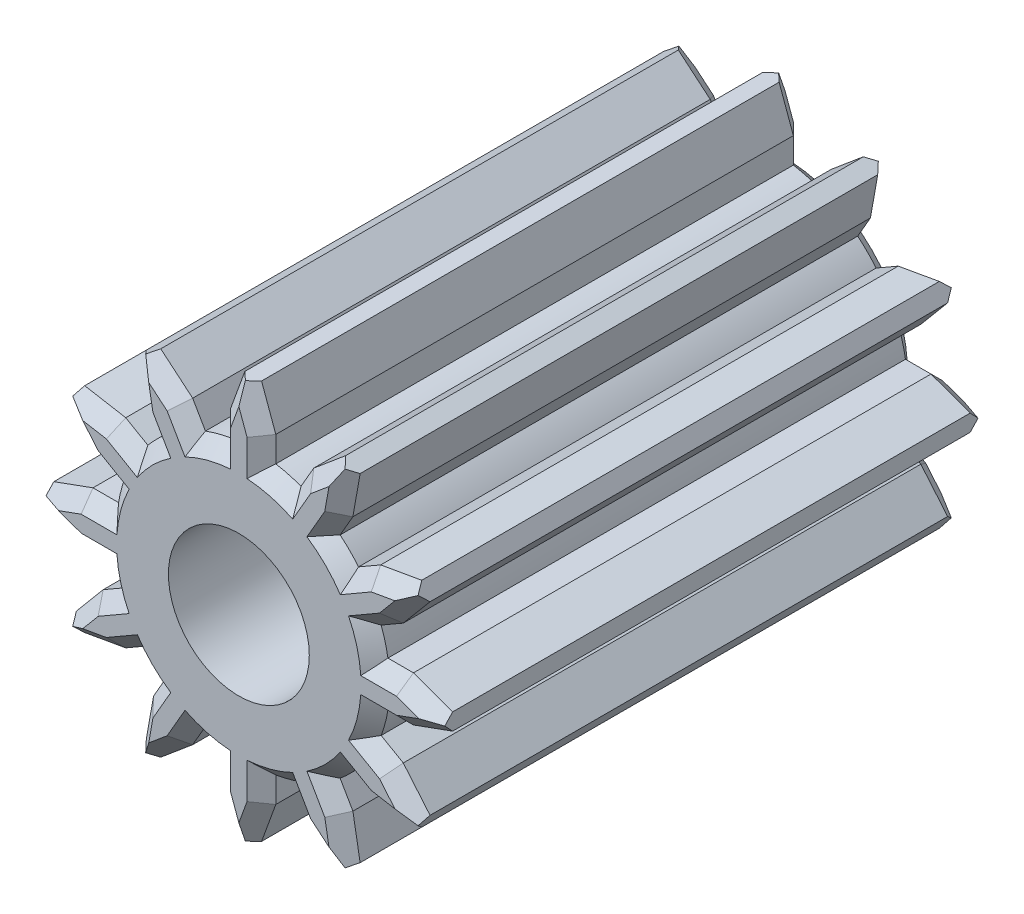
SolidWorks part; units mm, degrees
ref_plane "Piano frontale" through (0, 0, 0) normal (0, 0, 1) x (1, 0, 0)
ref_plane "Piano superiore" through (0, 0, 0) normal (0, 1, 0) x (1, 0, 0)
ref_plane "Piano destro" through (0, 0, 0) normal (1, 0, 0) x (0, 0, -1)
sketch "Schizzo1" plane through (0, 0, 0) normal (0, 0, 1) x (1, 0, 0)
  line L0 (-0.7855, 4.6846) -> (-0.7855, 5.5726)
  line L1 (-0.7855, 5.5726) -> (-0.2898, 6.9346)
  line L2 (-0.2898, 6.9346) -> (0.2898, 6.9346)
  line L3 (0.2898, 6.9346) -> (0.7855, 5.5726)
  line L4 (0.7855, 5.5726) -> (0.7855, 4.6846)
  line L5 (0, -8.4939) -> (0, 8.1917) construction
  line L6 (2.106, 5.2188) -> (3.2164, 6.1504)
  line L7 (1.662, 4.4497) -> (2.106, 5.2188)
  line L8 (3.7183, 5.8607) -> (3.4666, 4.4333)
  line L9 (3.4666, 4.4333) -> (3.0226, 3.6642)
  line L10 (3.2164, 6.1504) -> (3.7183, 5.8607)
  line L11 (4.4333, 3.4666) -> (5.8607, 3.7183)
  line L12 (3.6642, 3.0226) -> (4.4333, 3.4666)
  line L13 (6.1504, 3.2164) -> (5.2188, 2.106)
  line L14 (5.2188, 2.106) -> (4.4497, 1.662)
  line L15 (5.8607, 3.7183) -> (6.1504, 3.2164)
  line L16 (5.5726, 0.7855) -> (6.9346, 0.2898)
  line L17 (4.6846, 0.7855) -> (5.5726, 0.7855)
  line L18 (6.9346, -0.2898) -> (5.5726, -0.7855)
  line L19 (5.5726, -0.7855) -> (4.6846, -0.7855)
  line L20 (6.9346, 0.2898) -> (6.9346, -0.2898)
  line L21 (5.2188, -2.106) -> (6.1504, -3.2164)
  line L22 (4.4497, -1.662) -> (5.2188, -2.106)
  line L23 (5.8607, -3.7183) -> (4.4333, -3.4666)
  line L24 (4.4333, -3.4666) -> (3.6642, -3.0226)
  line L25 (6.1504, -3.2164) -> (5.8607, -3.7183)
  line L26 (3.4666, -4.4333) -> (3.7183, -5.8607)
  line L27 (3.0226, -3.6642) -> (3.4666, -4.4333)
  line L28 (3.2164, -6.1504) -> (2.106, -5.2188)
  line L29 (2.106, -5.2188) -> (1.662, -4.4497)
  line L30 (3.7183, -5.8607) -> (3.2164, -6.1504)
  line L31 (0.7855, -5.5726) -> (0.2898, -6.9346)
  line L32 (0.7855, -4.6846) -> (0.7855, -5.5726)
  line L33 (-0.2898, -6.9346) -> (-0.7855, -5.5726)
  line L34 (-0.7855, -5.5726) -> (-0.7855, -4.6846)
  line L35 (0.2898, -6.9346) -> (-0.2898, -6.9346)
  line L36 (-2.106, -5.2188) -> (-3.2164, -6.1504)
  line L37 (-1.662, -4.4497) -> (-2.106, -5.2188)
  line L38 (-3.7183, -5.8607) -> (-3.4666, -4.4333)
  line L39 (-3.4666, -4.4333) -> (-3.0226, -3.6642)
  line L40 (-3.2164, -6.1504) -> (-3.7183, -5.8607)
  line L41 (-4.4333, -3.4666) -> (-5.8607, -3.7183)
  line L42 (-3.6642, -3.0226) -> (-4.4333, -3.4666)
  line L43 (-6.1504, -3.2164) -> (-5.2188, -2.106)
  line L44 (-5.2188, -2.106) -> (-4.4497, -1.662)
  line L45 (-5.8607, -3.7183) -> (-6.1504, -3.2164)
  line L46 (-5.5726, -0.7855) -> (-6.9346, -0.2898)
  line L47 (-4.6846, -0.7855) -> (-5.5726, -0.7855)
  line L48 (-6.9346, 0.2898) -> (-5.5726, 0.7855)
  line L49 (-5.5726, 0.7855) -> (-4.6846, 0.7855)
  line L50 (-6.9346, -0.2898) -> (-6.9346, 0.2898)
  line L51 (-5.2188, 2.106) -> (-6.1504, 3.2164)
  line L52 (-4.4497, 1.662) -> (-5.2188, 2.106)
  line L53 (-5.8607, 3.7183) -> (-4.4333, 3.4666)
  line L54 (-4.4333, 3.4666) -> (-3.6642, 3.0226)
  line L55 (-6.1504, 3.2164) -> (-5.8607, 3.7183)
  line L56 (-3.4666, 4.4333) -> (-3.7183, 5.8607)
  line L57 (-3.0226, 3.6642) -> (-3.4666, 4.4333)
  line L58 (-3.2164, 6.1504) -> (-2.106, 5.2188)
  line L59 (-2.106, 5.2188) -> (-1.662, 4.4497)
  line L60 (-3.7183, 5.8607) -> (-3.2164, 6.1504)
  circle A0 centre (0, 0) radius 4.75
  point P79 (0, 0)
  dimension "D2" = 9.5
  dimension "D1" = 20
  dimension "D3" = 2.25
  dimension "D4" = 1.571
  dimension "D5" = 1.362
  dimension "D6" = 12
extrude "Estrusione-Estrusione1" add sketch "Schizzo1" along normal blind 19 contours A0 L5 | L5 A0 | L5 A0 L4 L3 L2 | A0 L5 L2 L1 L0 | A0 L59 L58 L60 L56 L57 | A0 L54 L53 L55 L51 L52 | A0 L49 L48 L50 L46 L47 | A0 L44 L43 L45 L41 L42 | A0 L39 L38 L40 L36 L37 | L5 L35 L31 L32 A0 | L35 L5 A0 L34 L33 | A0 L29 L28 L30 L26 L27 | A0 L24 L23 L25 L21 L22 | A0 L19 L18 L20 L16 L17 | A0 L14 L13 L15 L11 L12 | A0 L9 L8 L10 L6 L7
chamfer "Smusso1" distance 0.5 angle 45 144 edges at (0.7855, 5.1286, 0) (0.7855, 5.1286, 19) (1.2294, 4.5881, 19) (1.2294, 4.5881, 0) (1.884, 4.8342, 0) (1.884, 4.8342, 19) (2.6612, 5.6846, 0) (2.6612, 5.6846, 19) (3.5924, 5.147, 0) (3.5924, 5.147, 19) (3.2446, 4.0487, 0) (3.2446, 4.0487, 19) (3.3588, 3.3588, 19) (3.3588, 3.3588, 0) (4.0487, 3.2446, 0) (4.0487, 3.2446, 19) (5.147, 3.5924, 0) (5.147, 3.5924, 19) (5.6846, 2.6612, 0) (5.6846, 2.6612, 19) (4.8342, 1.884, 0) (4.8342, 1.884, 19) (4.5881, 1.2294, 19) (4.5881, 1.2294, 0) (5.1286, 0.7855, 0) (5.1286, 0.7855, 19) (6.2536, 0.5376, 0) (6.2536, 0.5376, 19) (6.2536, -0.5376, 0) (6.2536, -0.5376, 19) (5.1286, -0.7855, 0) (5.1286, -0.7855, 19) (4.5881, -1.2294, 19) (4.5881, -1.2294, 0) (4.8342, -1.884, 0) (4.8342, -1.884, 19) (5.6846, -2.6612, 0) (5.6846, -2.6612, 19) (5.147, -3.5924, 0) (5.147, -3.5924, 19) (4.0487, -3.2446, 0) (4.0487, -3.2446, 19) (3.3588, -3.3588, 19) (3.3588, -3.3588, 0) (3.2446, -4.0487, 0) (3.2446, -4.0487, 19) (3.5924, -5.147, 0) (3.5924, -5.147, 19) (2.6612, -5.6846, 0) (2.6612, -5.6846, 19) (1.884, -4.8342, 0) (1.884, -4.8342, 19) (1.2294, -4.5881, 19) (1.2294, -4.5881, 0) (0.7855, -5.1286, 0) (0.7855, -5.1286, 19) (0.5376, -6.2536, 0) (0.5376, -6.2536, 19) (-0.5376, -6.2536, 0) (-0.5376, -6.2536, 19) (-0.7855, -5.1286, 0) (-0.7855, -5.1286, 19) (-1.2294, -4.5881, 19) (-1.2294, -4.5881, 0) (-1.884, -4.8342, 0) (-1.884, -4.8342, 19) (-2.6612, -5.6846, 0) (-2.6612, -5.6846, 19) (-3.5924, -5.147, 0) (-3.5924, -5.147, 19) (-3.2446, -4.0487, 0) (-3.2446, -4.0487, 19) (-3.3588, -3.3588, 19) (-3.3588, -3.3588, 0) (-4.0487, -3.2446, 0) (-4.0487, -3.2446, 19) (-5.147, -3.5924, 0) (-5.147, -3.5924, 19) (-5.6846, -2.6612, 0) (-5.6846, -2.6612, 19) (-4.8342, -1.884, 0) (-4.8342, -1.884, 19) (-4.5881, -1.2294, 19) (-4.5881, -1.2294, 0) (-5.1286, -0.7855, 0) (-5.1286, -0.7855, 19) (-6.2536, -0.5376, 0) (-6.2536, -0.5376, 19) (-6.2536, 0.5376, 0) (-6.2536, 0.5376, 19) (-5.1286, 0.7855, 0) (-5.1286, 0.7855, 19) (-4.5881, 1.2294, 19) (-4.5881, 1.2294, 0) (-4.8342, 1.884, 0) (-4.8342, 1.884, 19) (-5.6846, 2.6612, 0) (-5.6846, 2.6612, 19) (-5.147, 3.5924, 0) (-5.147, 3.5924, 19) (-4.0487, 3.2446, 0) (-4.0487, 3.2446, 19) (-3.3588, 3.3588, 19) (-3.3588, 3.3588, 0) (-3.2446, 4.0487, 0) (-3.2446, 4.0487, 19) (-3.5924, 5.147, 0) (-3.5924, 5.147, 19) (-2.6612, 5.6846, 0) (-2.6612, 5.6846, 19) (-1.884, 4.8342, 0) (-1.884, 4.8342, 19) (-1.2294, 4.5881, 19) (-1.2294, 4.5881, 0) (-0.7855, 5.1286, 0) (-0.7855, 5.1286, 19) (-0.5376, 6.2536, 0) (-0.5376, 6.2536, 19) (0.5376, 6.2536, 0) (0.5376, 6.2536, 19) (6.0055, 3.4673, 0) (6.0055, 3.4673, 19) (3.4673, 6.0055, 0) (3.4673, 6.0055, 19) (0, 6.9346, 0) (0, 6.9346, 19) (-3.4673, 6.0055, 0) (-3.4673, 6.0055, 19) (-6.0055, 3.4673, 0) (-6.0055, 3.4673, 19) (-6.9346, 0, 0) (-6.9346, 0, 19) (-6.0055, -3.4673, 0) (-6.0055, -3.4673, 19) (-3.4673, -6.0055, 0) (-3.4673, -6.0055, 19) (0, -6.9346, 0) (0, -6.9346, 19) (3.4673, -6.0055, 0) (3.4673, -6.0055, 19) (6.0055, -3.4673, 0) (6.0055, -3.4673, 19) (6.9346, 0, 0) (6.9346, 0, 19)
sketch "Schizzo2" plane through (0, 0, 19) normal (0, 0, 1) x (1, 0, 0)
  circle A0 centre (0, 0) radius 2.45
  dimension "D1" = 4.9
extrude "Taglio-Estrusione1" cut sketch "Schizzo2" against normal through all
sketch "Schizzo3" plane through (0, 0, 19) normal (0, 0, 1) x (1, 0, 0)
  circle A0 centre (0, 0) radius 6 construction
  dimension "D1" = 12
